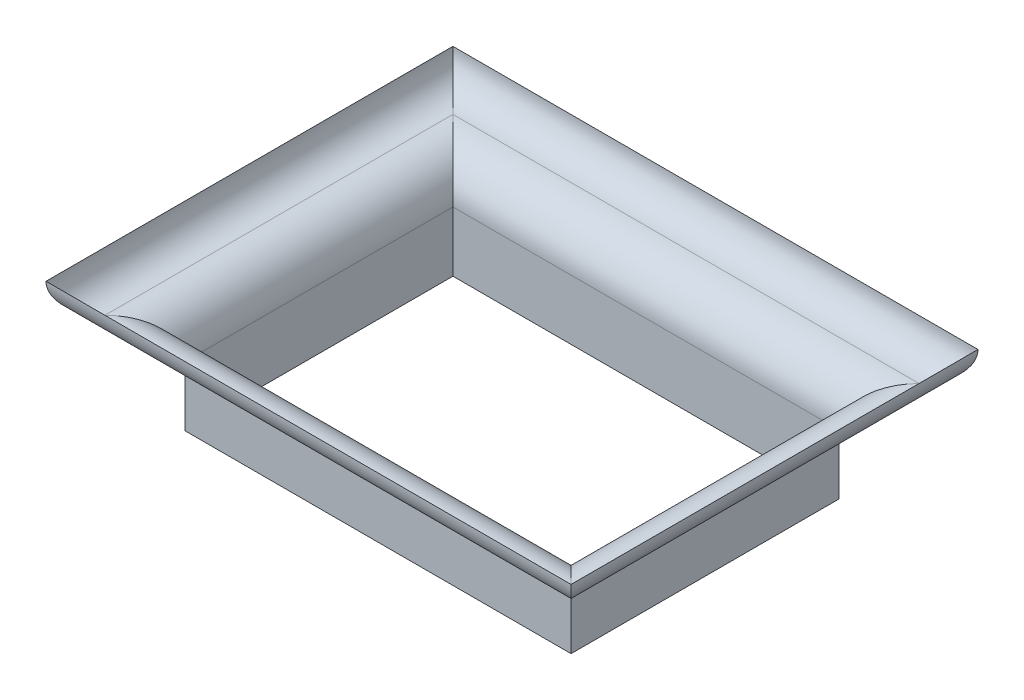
SolidWorks part; units mm, degrees
ref_plane "Front" through (0, 0, 0) normal (0, 0, 1) x (1, 0, 0)
ref_plane "Top" through (0, 0, 0) normal (0, 1, 0) x (1, 0, 0)
ref_plane "Right" through (0, 0, 0) normal (1, 0, 0) x (0, 0, -1)
sketch "Sketch2" plane through (0, 0, 0) normal (0, 1, 0) x (1, 0, 0)
  line L1 (0, 0) -> (89.206, 0)
  line L2 (0, 0) -> (0, 61.9019)
  line L3 (0, 61.9019) -> (89.206, 61.9019)
  line L4 (89.206, 0) -> (89.206, 61.9019)
sketch "Sketch3" plane through (0, 0, 0) normal (0, 0, 1) x (1, 0, 0)
  line L0 (0, 0) -> (0, 13.8659)
  arc A0 (0, 13.8659) -> (-9.2671, 23.1329) centre (-9.2671, 13.8659) ccw
  arc A1 (-9.2671, 23.1329) -> (-16.0778, 29.9437) centre (-9.2671, 29.9437) cw
surface "Surface-Sweep2"
